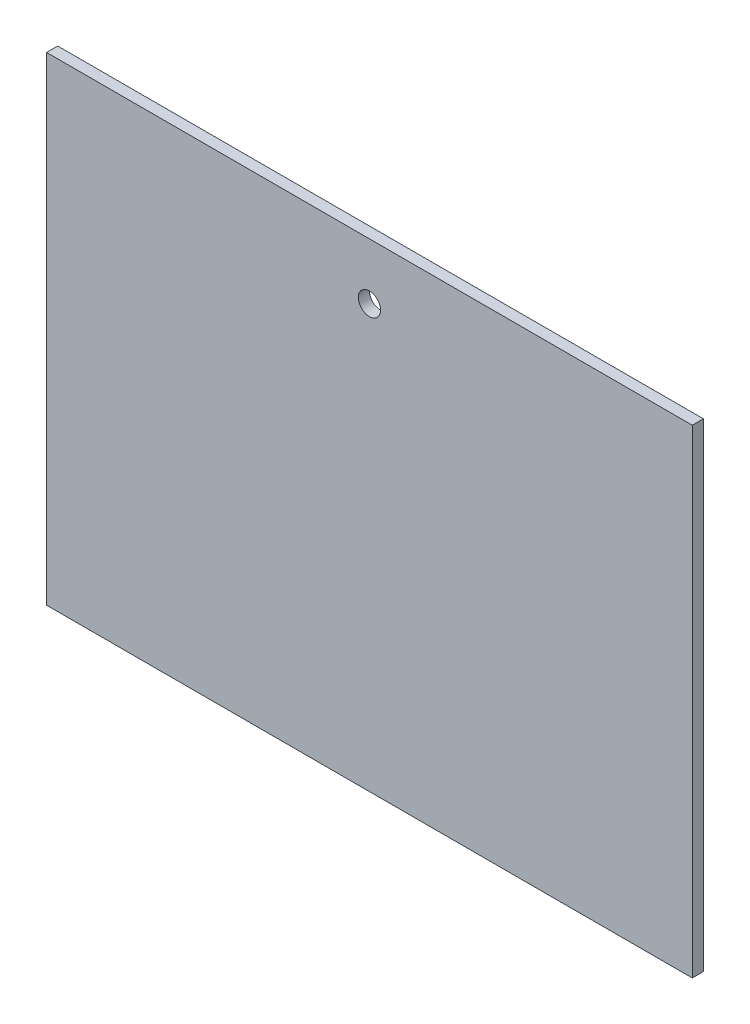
SolidWorks part; units mm, degrees
ref_plane "Plan de face" through (0, 0, 0) normal (0, 0, 1) x (1, 0, 0)
ref_plane "Plan de dessus" through (0, 0, 0) normal (0, 1, 0) x (1, 0, 0)
ref_plane "Plan de droite" through (0, 0, 0) normal (1, 0, 0) x (0, 0, -1)
sketch "Esquisse1" plane through (0, 0, 0) normal (0, 0, 1) x (1, 0, 0)
  line L0 (-69.2839, 50.5271) -> (-69.2839, -379.4729)
  line L5 (-79.2839, 50.5271) -> (-69.2839, 50.5271)
  line L9 (520.7161, 50.5271) -> (-79.2839, 50.5271)
  line L10 (520.7161, 50.5271) -> (520.7161, -379.4729)
  line L11 (520.7161, -379.4729) -> (-79.2839, -379.4729)
  line L25 (520.7161, 50.5271) -> (-79.2839, 50.5271)
  line L26 (520.7161, 50.5271) -> (520.7161, -379.4729)
  line L27 (520.7161, -379.4729) -> (-79.2839, -379.4729)
  line L28 (-79.2839, 50.5271) -> (-79.2839, -379.4729)
  line L29 (520.7161, -379.4729) -> (510.7161, -379.4729)
  line L30 (520.7161, -379.4729) -> (520.7161, -369.4729)
  line L31 (520.7161, -369.4729) -> (510.7161, -369.4729)
  line L32 (510.7161, -379.4729) -> (510.7161, -369.4729)
  line L33 (-79.2839, -379.4729) -> (-69.2839, -379.4729)
  line L34 (-79.2839, -379.4729) -> (-79.2839, -369.4729)
  line L35 (-79.2839, -369.4729) -> (-69.2839, -369.4729)
  line L36 (-69.2839, -379.4729) -> (-69.2839, -369.4729)
  line L37 (510.7161, -379.4729) -> (510.7161, 50.5271)
  dimension "D1" = 10
  dimension "D2" = 600
  dimension "D3" = 10
  dimension "D4" = 10
  dimension "D5" = 430
  dimension "D6" = 600
  dimension "D7" = 430
  dimension "D8" = 600
extrude "Boss.-Extru.1" add sketch "Esquisse1" along normal blind 10 contours L36 L27 L32 L31 L10 L9 L5 L28 L35
sketch "Esquisse2" plane through (0, 0, 10) normal (0, 0, 1) x (1, 0, 0)
  line L2 (-69.2839, 50.5271) -> (-69.2839, -379.4729) construction
  circle A0 centre (220.7161, 0) radius 10
  dimension "D1" = 290
extrude "Enlèv. mat.-Extru.1" cut sketch "Esquisse2" against normal blind 30
